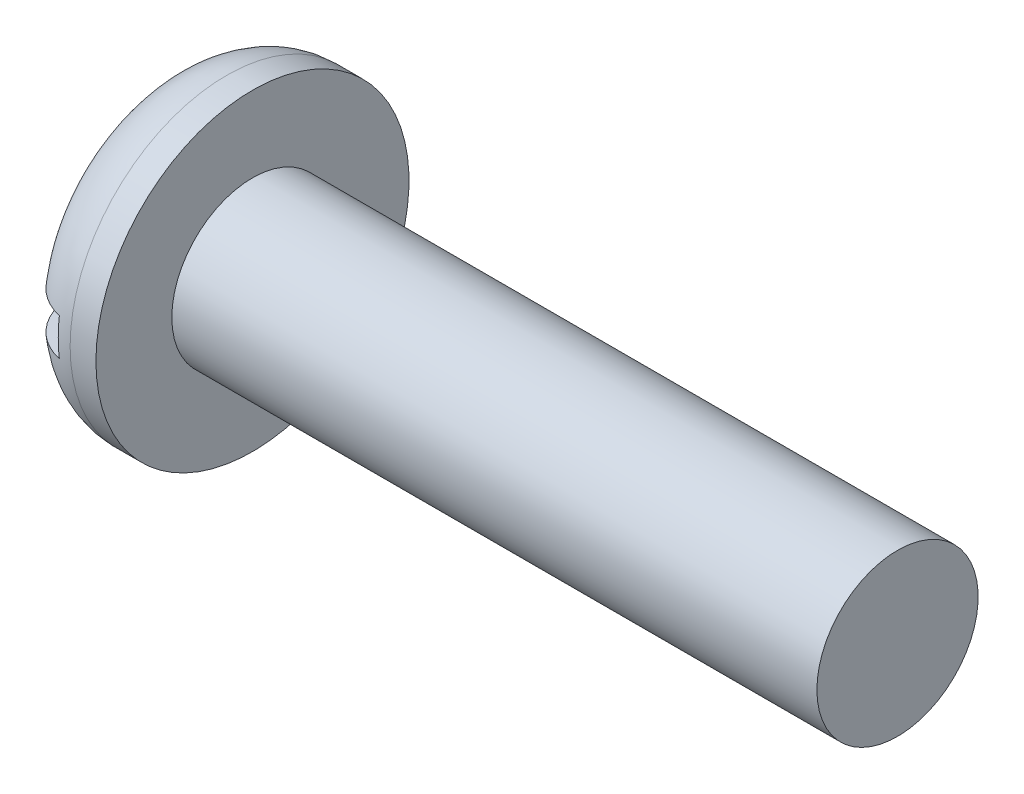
SolidWorks part; units mm, degrees
ref_plane "Plane1" through (0, 0, 0) normal (0, 0, 1) x (1, 0, 0)
ref_plane "Plane2" through (0, 0, 0) normal (0, 1, 0) x (1, 0, 0)
ref_plane "Plane3" through (0, 0, 0) normal (1, 0, 0) x (0, 0, -1)
other "Configuration Table"
sketch "BodySke" plane through (0, 0, 0) normal (0, 0, 1) x (1, 0, 0)
  line L0 (5.1562, 4.7625) -> (5.1562, 9.2456)
  line L1 (0, 0) -> (0, 5.6134)
  line L2 (-25.4, 0) -> (127, 0) construction
  line L3 (43.2562, 0) -> (0, 0)
  line L4 (5.1562, 4.7625) -> (43.2562, 4.7625)
  line L5 (43.2562, 4.7625) -> (43.2562, 0)
  line L6 (3.6322, 9.2456) -> (5.1562, 9.2456)
  line L7 (5.1562, -4.7625) -> (43.2562, -4.7625) construction
  line L8 (0, -9.2456) -> (5.1562, -9.2456) construction
  line L9 (6.7437, 6.35) -> (6.7437, -3.175) construction
  line L10 (11.5062, 6.35) -> (11.5062, -3.175) construction
  arc A0 (0, 5.6134) -> (3.6322, 9.2456) centre (3.6322, 5.6134) cw
  point P15 (0, 9.2456)
revolve "Base-Revolve" add sketch "BodySke" angle 360 about L2
sketch "Sketch2" plane through (0, 0, 0) normal (1, 0, 0) x (0, 0, -1)
  line L0 (9.2456, -1.1049) -> (-9.2456, -1.1049)
  line L1 (9.2456, -1.1049) -> (9.2456, 1.1049)
  line L2 (-9.2456, 1.1049) -> (9.2456, 1.1049)
  line L3 (-9.2456, 1.1049) -> (-9.2456, -1.1049)
extrude "Slot" cut sketch "Sketch2" along normal blind 2.8448
sketch "ThdSchSke" plane through (0, 0, 0) normal (0, 0, 1) x (1, 0, 0)
  line L0 (11.5062, -3.9688) -> (10.9504, -4.7625)
  line L1 (11.5062, -3.9688) -> (12.062, -4.7625)
  line L2 (12.062, -4.7625) -> (12.062, -5.9531)
  line L3 (-3.175, 0) -> (5.1513, 0) construction
  line L5 (12.062, -5.9531) -> (10.9504, -5.9531)
  line L6 (10.9504, -5.9531) -> (10.9504, -4.7625)
revolve "ThreadSchematic" [suppressed] cut sketch "ThdSchSke" angle 360 about L3
pattern_linear "ThdSchPat" [suppressed]
equation "\"D1@Sketch2\" = \"Head_dia@BodySke\""
equation "\"D2@Sketch2\" = \"D1@Sketch2\" / 2"
equation "\"D3@Sketch2\" = \"Slot_width@Sketch2\" / 2"
equation "\"Thread_length@ThreadCosmetic\" = ((sgn( (\"Length@BodySke\" - \"Advance@BodySke\" ) - \"Thread_nom@BodySke\" )-1)*( (\"Length@BodySke\" - \"Advance@BodySke\" ) - \"Thread_nom@BodySke\" ))/-2+ \"Thread_nom@BodySke\""
equation "\"Thread_minor@ThdSchSke\" = \"Thread_minor@ThreadCosmetic\""
equation "\"Diameter@ThdSchSke\" = \"Diameter@BodySke\""
equation "\"Overcut@ThdSchSke\" = \"Diameter@BodySke\" * 1.25"
equation "\"Start@ThdSchSke\" = \"Head_ht@BodySke\" + \"Length@BodySke\" - \"Thread_length@ThreadCosmetic\"  '---Non-countersunk---"
equation "\"Num_threads@ThdSchPat\" = int( \"Thread_length@ThreadCosmetic\" / \"Advance@BodySke\" + 0.999 )  + 1"
equation "\"Advance@ThdSchPat\" = \"Thread_length@ThreadCosmetic\" /  (\"Num_threads@ThdSchPat\" - 1) 'relax it"
